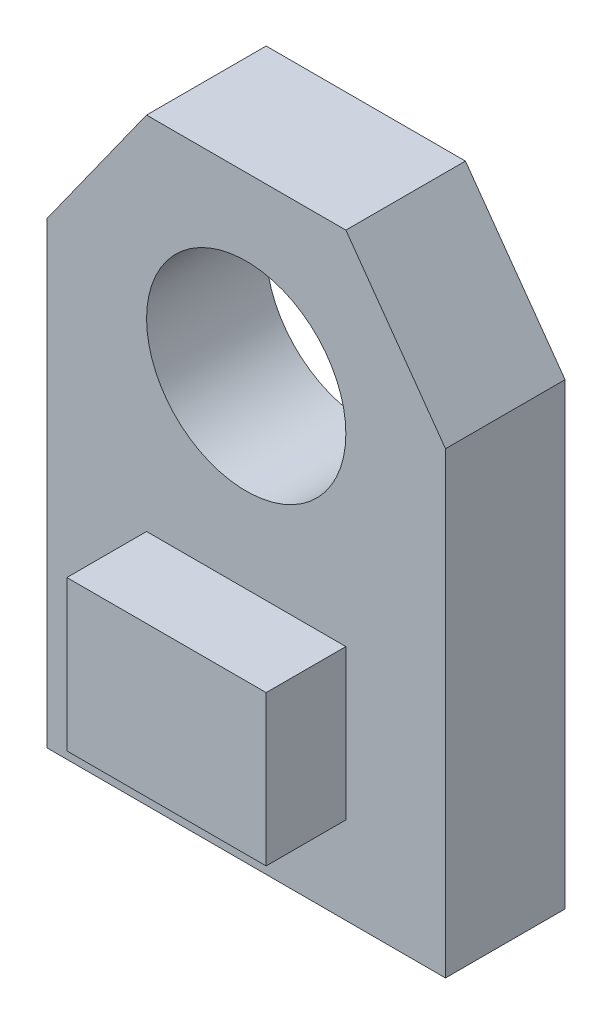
SolidWorks part; units mm, degrees
ref_plane "前视基准面" through (0, 0, 0) normal (0, 0, 1) x (1, 0, 0)
ref_plane "上视基准面" through (0, 0, 0) normal (0, 1, 0) x (1, 0, 0)
ref_plane "右视基准面" through (0, 0, 0) normal (1, 0, 0) x (0, 0, -1)
sketch "草图1" plane through (0, 0, 0) normal (0, 0, 1) x (1, 0, 0)
  line L0 (0, -26.8761) -> (0, 73.501) construction
  line L1 (10, 60) -> (-10, 60)
  line L2 (-10, 60) -> (-20, 46)
  line L3 (-20, 46) -> (-20, 0)
  line L4 (-20, 0) -> (20, 0)
  line L5 (20, 46) -> (20, 0)
  line L6 (10, 60) -> (20, 46)
  point P9 (0, 0)
  point P11 (0, 60)
  dimension "D1" = 10
  dimension "D2" = 20
  dimension "D3" = 46
  dimension "D4" = 60
extrude "凸台-拉伸1" add sketch "草图1" along normal blind 12
sketch "草图2" plane through (0, 0, 12) normal (0, 0, 1) x (1, 0, 0)
  line L0 (0, -1.1644) -> (0, 61.4244) construction
  line L1 (-14.0566, 42.3115) -> (13.7229, 42.3115) construction
  circle A0 centre (0, 42.3115) radius 10
  dimension "D1" = 20
sketch "草图3" plane through (0, 0, 12) normal (0, 0, 1) x (1, 0, 0)
  line L0 (0, 55.5591) -> (0, 6.2092) construction
  line L1 (0, -1.1644) -> (0, 61.4244) construction
  line L2 (-10, 23.8052) -> (10, 23.8052)
  line L3 (10, 23.8052) -> (10, 8.7373)
  line L4 (10, 8.7373) -> (-10, 8.7373)
  line L5 (-10, 23.8052) -> (-10, 8.7373)
  point P9 (0, 8.7373)
  point P10 (0, 23.8052)
extrude "切除-拉伸1" cut sketch "草图2" against normal blind 22
extrude "凸台-拉伸2" add sketch "草图3" along normal blind 8
